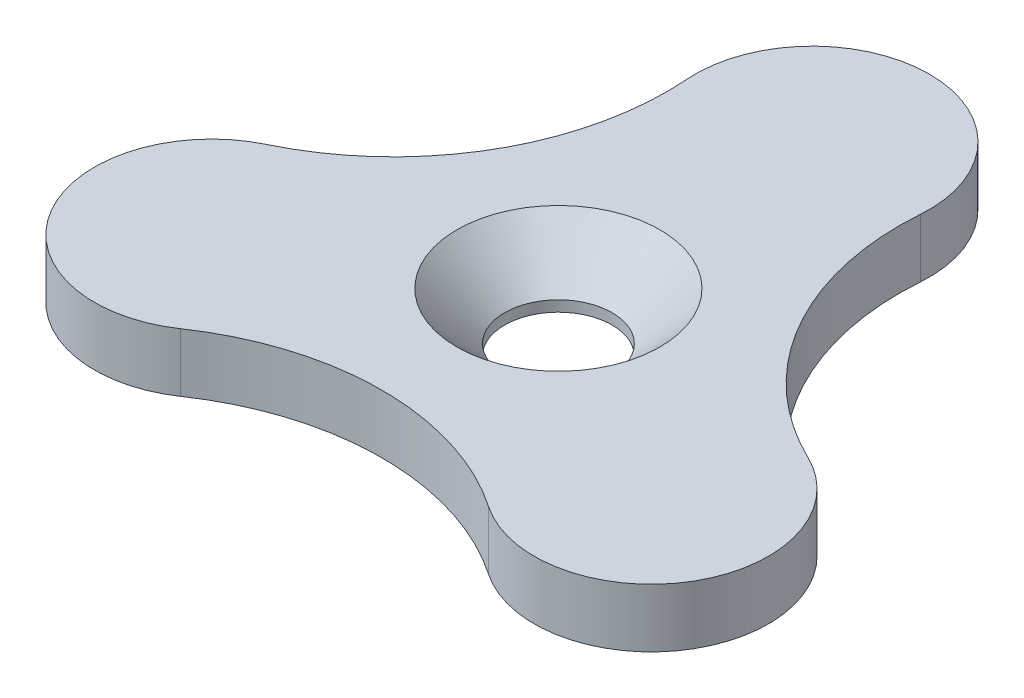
SolidWorks part; units mm, degrees
ref_plane "Front Plane" through (0, 0, 0) normal (0, 0, 1) x (1, 0, 0)
ref_plane "Top Plane" through (0, 0, 0) normal (0, 1, 0) x (1, 0, 0)
ref_plane "Right Plane" through (0, 0, 0) normal (1, 0, 0) x (0, 0, -1)
sketch "Sketch1" plane through (0, 0, 0) normal (0, 1, 0) x (1, 0, 0)
  line L0 (0, 0) -> (0, 13) construction
  line L1 (0, 0) -> (11.2583, -6.5) construction
  line L2 (0, 0) -> (-11.2583, -6.5) construction
  line L3 (0, 0) -> (-13, 0) construction
  circle A0 centre (0, 0) radius 13 construction
  arc A1 (5.9834, 12.5545) -> (-5.9834, 12.5545) centre (0, 13) ccw
  arc A2 (7.8808, -11.4591) -> (13.8643, -1.0955) centre (11.2583, -6.5) ccw
  arc A3 (-13.8643, -1.0955) -> (-7.8808, -11.4591) centre (-11.2583, -6.5) ccw
  arc A4 (-13.8643, -1.0955) -> (-5.9834, 12.5545) centre (-19.9448, 11.5151) ccw
  arc A5 (5.9834, 12.5545) -> (13.8643, -1.0955) centre (19.9448, 11.5151) ccw
  arc A6 (7.8808, -11.4591) -> (-7.8808, -11.4591) centre (0, -23.0303) ccw
  dimension "D1" = 26
  dimension "D2" = 12
  dimension "D4" = 28
  dimension "D3" = 120
  dimension "D5" = 30
extrude "Extrude1" add sketch "Sketch1" along normal blind 3
hole_wizard "CSK for M5 Countersunk Flat Head Screw2" positions "3DSketch2" profile "Sketch4" countersink size "M5" standard "ISO"
sketch3d "3DSketch2"
  line L0 (0, 3, -13) -> (0, 3, 0) construction
  line L1 (0, 3, -13) -> (0, 0, -13) construction
  arc A0 (5.9834, 3, -12.5545) -> (-5.9834, 3, -12.5545) centre (0, 3, -13) ccw construction
  point P0 (0, 3, 0)
  point P7 (0, 9, -13)
  dimension "D1" = 13
sketch "Sketch4" plane through (0, 3, 0) normal (1, 0, 0) x (0, 0, 1)
  line L0 (0, 0) -> (0, 3)
  line L1 (0, 3) -> (2.75, 3)
  line L2 (2.75, 3) -> (2.75, 2.45)
  line L3 (2.75, 2.45) -> (5.2, 0)
  line L5 (5.2, 0) -> (0, 0)
  line L6 (-2.75, 2.45) -> (-5.2, 0) construction
  line L11 (0, -6.35) -> (0, 107.95) construction
  dimension "Thru Hole Dia." = 5.5
  dimension "Thru Hole Depth" = 3
  dimension "Near C'Sink Dia." = 10.4
  dimension "Near C'Sink Angle" = 90
